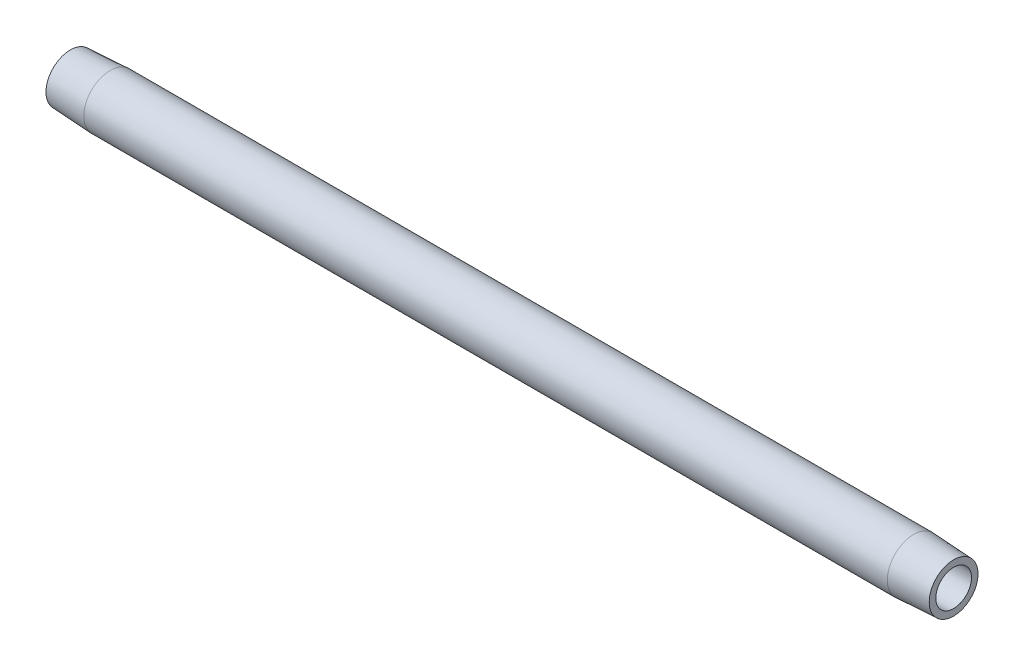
SolidWorks part; units mm, degrees
ref_plane "Front Plane" through (0, 0, 0) normal (0, 0, 1) x (1, 0, 0)
ref_plane "Top Plane" through (0, 0, 0) normal (0, 1, 0) x (1, 0, 0)
ref_plane "Right Plane" through (0, 0, 0) normal (1, 0, 0) x (0, 0, -1)
sketch "Sketch1" plane through (0, 0, 0) normal (0, 1, 0) x (1, 0, 0)
  line L6 (228.6, 4.6228) -> (0, 4.6228)
  line L7 (10.3124, 6.858) -> (0, 6.3175)
  line L8 (0, 6.3175) -> (0, 4.6228)
  line L9 (218.2876, 6.858) -> (10.3124, 6.858)
  line L10 (228.6, 6.3175) -> (218.2876, 6.858)
  line L11 (228.6, 4.6228) -> (228.6, 6.3175)
  line L12 (-6.376, 0) -> (49993.624, 0) construction
  dimension "D1" = 9.2456
  dimension "D2" = 13.716
  dimension "D3" = 3
  dimension "D4" = 3
  dimension "D5" = 228.6
  dimension "D6" = 10.3124
  dimension "D7" = 10.3124
revolve "Revolve1" add sketch "Sketch1" angle 360 about L12
